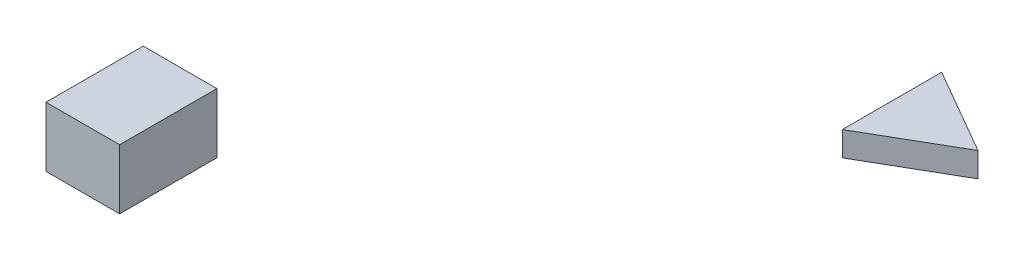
SolidWorks part; units mm, degrees
ref_plane "Front Plane" through (0, 0, 0) normal (0, 0, 1) x (1, 0, 0)
ref_plane "Top Plane" through (0, 0, 0) normal (0, 1, 0) x (1, 0, 0)
ref_plane "Right Plane" through (0, 0, 0) normal (1, 0, 0) x (0, 0, -1)
sketch "Sketch1" plane through (0, 0, 0) normal (0, 1, 0) x (1, 0, 0)
  point P0 (101.3439, 0)
sketch "Sketch2" plane through (0, 0, 0) normal (0, 1, 0) x (1, 0, 0)
  line L0 (381, 51.6472) -> (381, -51.1037)
  line L1 (381, -51.1037) -> (469.9848, 0.2718)
  line L2 (469.9848, 0.2718) -> (381, 51.6472)
  dimension "D1" = 381
extrude "Extrude1" add sketch "Sketch2" along normal mid plane 25.4
sketch "Sketch3" plane through (0, 0, 0) normal (1, 0, 0) x (0, 0, -1)
  line L1 (-456.2483, 30.1998) -> (-355.6, 30.1998)
  line L2 (-456.2483, 30.1998) -> (-456.2483, -31.8068)
  line L3 (-456.2483, -31.8068) -> (-355.6, -31.8068)
  line L4 (-355.6, 30.1998) -> (-355.6, -31.8068)
  dimension "D1" = 355.6
extrude "Extrude2" add sketch "Sketch3" along normal mid plane 76.2
